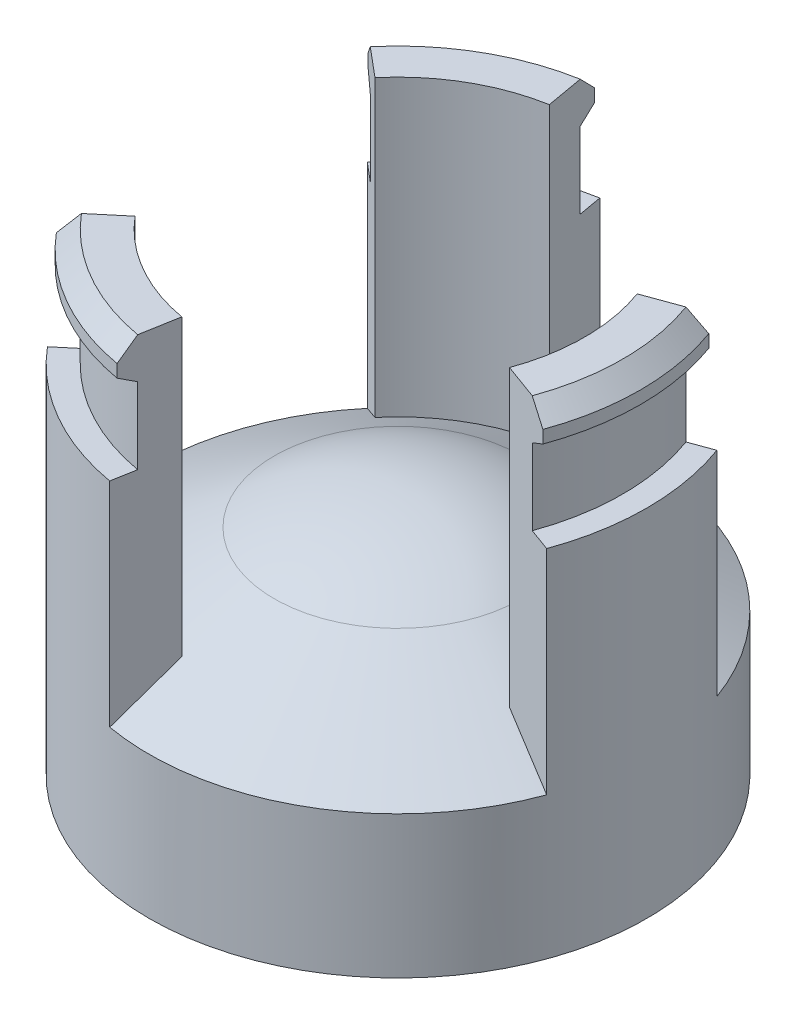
SolidWorks part; units mm, degrees
ref_plane "Plan de face" through (0, 0, 0) normal (0, 0, 1) x (1, 0, 0)
ref_plane "Plan de dessus" through (0, 0, 0) normal (0, 1, 0) x (1, 0, 0)
ref_plane "Plan de droite" through (0, 0, 0) normal (1, 0, 0) x (0, 0, -1)
sketch "Esquisse1" plane through (0, 0, 0) normal (0, 0, 1) x (1, 0, 0)
  line L0 (0, 8.25) -> (0, 9.7497)
  line L9 (8.25, 0) -> (9.8, 0)
  line L10 (9.8, 0) -> (9.8, 5.6)
  line L11 (9.8, 5.6) -> (4.8749, 8.4435)
  arc A0 (0, 8.25) -> (8.25, 0) centre (0, 0) cw
  arc A2 (4.8749, 8.4435) -> (0, 9.7497) centre (0, 0) ccw
  dimension "D2" = 8.25
  dimension "D7" = 5.6
  dimension "D5" = 120
  dimension "D4" = 9.8
revolve "Révolution1" add sketch "Esquisse1" angle 360 about L0
sketch "Esquisse3" plane through (0, 0, 0) normal (0, 0, 1) x (1, 0, 0)
  line L0 (7.35, 6.6) -> (7.35, 18.6041)
  line L1 (-8.25, 0) -> (8.25, 0) construction
  line L2 (7.35, 18.6041) -> (8.85, 18.6041)
  line L3 (8.85, 18.6041) -> (9.55, 17.9041)
  line L4 (9.55, 17.9041) -> (9.55, 17.4041)
  line L6 (8.85, 17) -> (8.85, 14)
  line L7 (8.85, 14) -> (9.8, 14)
  line L8 (9.8, 14) -> (9.8, 5.6)
  line L9 (7.35, 6.6) -> (9.8, 5.6)
  line L10 (9.8, 5.6) -> (-9.8, 5.6) construction
  line L11 (0, 0) -> (0, 22.3065) construction
  line L12 (9.55, 17.4041) -> (8.85, 17)
  dimension "D1" = 0
  dimension "D2" = 1
  dimension "D3" = 17.7
  dimension "D5" = 14
  dimension "D6" = 2.2
  dimension "D7" = 120
  dimension "D8" = 1.5
  dimension "D9" = 3
  dimension "D10" = 0.7
  dimension "D11" = 0.7
  dimension "D12" = 0.5
revolve "Révolution2" add sketch "Esquisse3" angle 20 about L11
pattern_circular "Répétition circulaire1" count 3 every 120 about axis through (0, 0, 0) along (0, 1, 0) of "Révolution2"
